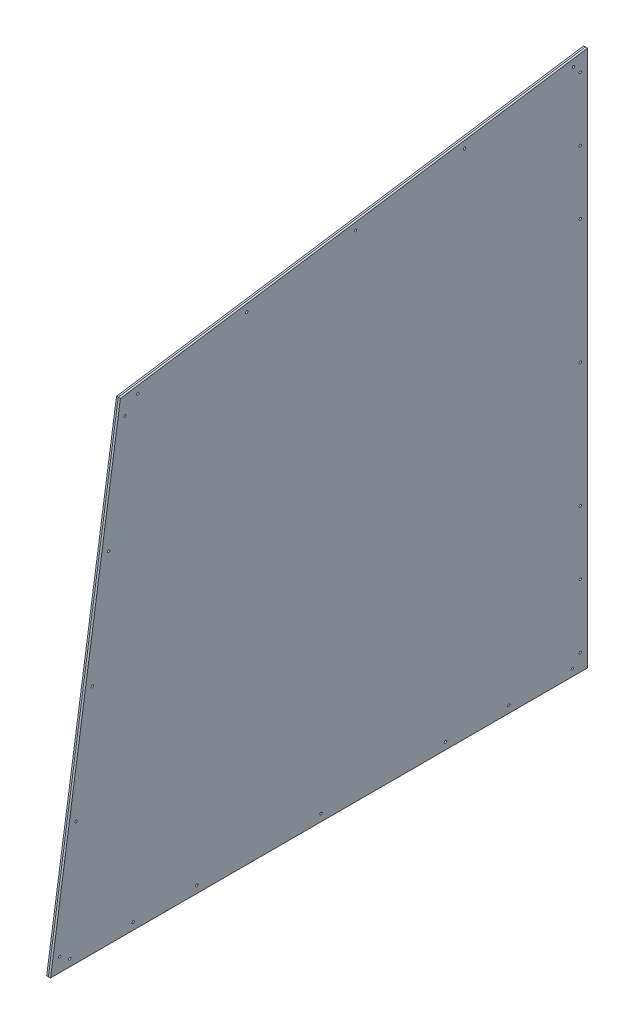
SolidWorks part; units mm, degrees
ref_plane "Front Plane" through (0, 0, 0) normal (0, 0, 1) x (1, 0, 0)
ref_plane "Top Plane" through (0, 0, 0) normal (0, 1, 0) x (1, 0, 0)
ref_plane "Right Plane" through (0, 0, 0) normal (1, 0, 0) x (0, 0, -1)
sketch "Sketch2" plane through (0, 0, 0) normal (1, 0, 0) x (0, 0, -1)
  line L0 (-4.3656, 1212.1971) -> (-1055.0672, 1055.0672) construction
  line L1 (-1212.1971, 4.3656) -> (-1055.0672, 1055.0672) construction
  line L2 (-4.3656, 4.3656) -> (-1212.1971, 4.3656) construction
  line L3 (-4.3656, 4.3656) -> (-4.3656, 1212.1971) construction
  line L4 (-4.3656, 1212.1971) -> (-1055.0672, 1055.0672)
  line L5 (-1212.1971, 4.3656) -> (-1055.0672, 1055.0672)
  line L6 (-4.3656, 4.3656) -> (-1212.1971, 4.3656)
  line L7 (-4.3656, 4.3656) -> (-4.3656, 1212.1971)
extrude "Boss-Extrude1" add sketch "Sketch2" along normal mid plane 8.7312
sketch "Sketch3" plane through (0, 4.3656, 0) normal (0, -1, 0) x (1, 0, 0)
  line L0 (0, 1212.1971) -> (4.3656, 1211.5443)
  line L1 (4.3656, 1212.1971) -> (-4.3656, 1212.1971) construction
  line L2 (0, 1212.1971) -> (-4.3656, 1211.5443)
  line L3 (-4.3656, 1211.5443) -> (-4.3656, 1214.7371)
  line L4 (4.3656, 1211.5443) -> (4.3656, 1214.7371)
  line L5 (4.3656, 1214.7371) -> (-4.3656, 1214.7371)
  line L6 (4.3656, 1212.1971) -> (4.3656, 4.3656) construction
  line L7 (-4.3656, 1212.1971) -> (-4.3656, 4.3656) construction
  line L8 (0, 1212.85) -> (1055.0672, 1055.0672) construction
  dimension "D1" = 2.54
  dimension "D2" = 8.505
extrude "Cut-Extrude1" cut sketch "Sketch3" along direction (0, -0.989, 0.1479) on the side against the normal through all
sketch "Sketch4" plane through (0, 0, 4.3656) normal (0, 0, -1) x (-1, 0, 0)
  line L0 (0, 1212.1971) -> (-4.3656, 1211.5443)
  line L1 (-4.3656, 1212.1971) -> (4.3656, 1212.1971) construction
  line L2 (0, 1212.1971) -> (4.3656, 1211.5443)
  line L3 (-4.3656, 1211.5443) -> (-4.3656, 1214.7371)
  line L4 (-4.3656, 1214.7371) -> (4.3656, 1214.7371)
  line L5 (4.3656, 1214.7371) -> (4.3656, 1211.5443)
  line L6 (-4.3656, 4.3656) -> (-4.3656, 1212.1971) construction
  line L7 (4.3656, 4.3656) -> (4.3656, 1212.1971) construction
  line L8 (0, 1212.85) -> (-1055.0672, 1055.0672) construction
  dimension "D1" = 2.54
  dimension "D2" = 8.505
extrude "Cut-Extrude2" cut sketch "Sketch4" along direction (0, -0.1479, 0.989) on the side against the normal through all
sketch "Sketch5" plane through (4.3656, 0, 0) normal (1, 0, 0) x (0, 0, -1)
  line L0 (-4.3656, 20.2406) -> (-38.1, 20.2406) construction
  line L1 (-4.3656, 4.3656) -> (-4.3656, 1211.5443) construction
  line L2 (-1211.5443, 4.3656) -> (-4.3656, 4.3656) construction
  line L3 (-38.1, 20.2406) -> (-180.975, 20.2406) construction
  line L4 (-180.975, 20.2406) -> (-323.85, 20.2406) construction
  line L5 (-323.85, 20.2406) -> (-603.25, 20.2406) construction
  line L6 (-603.25, 20.2406) -> (-882.65, 20.2406) construction
  line L7 (-882.65, 20.2406) -> (-1025.525, 20.2406) construction
  line L8 (-1025.525, 20.2406) -> (-1168.4, 20.2406) construction
  line L9 (-1168.4, 20.2406) -> (-1209.1702, 20.2406) construction
  line L10 (-1211.5443, 4.3656) -> (-1054.4993, 1054.4993) construction
  line L11 (-20.2406, 4.3656) -> (-20.2406, 42.4656) construction
  line L12 (-1211.5443, 4.3656) -> (-4.3656, 4.3656) construction
  line L13 (-4.3656, 4.3656) -> (-4.3656, 1211.5443) construction
  line L14 (-20.2406, 42.4656) -> (-20.2406, 185.3406) construction
  line L15 (-20.2406, 185.3406) -> (-20.2406, 328.2156) construction
  line L16 (-20.2406, 328.2156) -> (-20.2406, 607.6156) construction
  line L17 (-20.2406, 607.6156) -> (-20.2406, 887.0156) construction
  line L18 (-20.2406, 887.0156) -> (-20.2406, 1029.8906) construction
  line L19 (-20.2406, 1029.8906) -> (-20.2406, 1172.7656) construction
  line L20 (-20.2406, 1172.7656) -> (-20.2406, 1209.1702) construction
  line L21 (-1054.4993, 1054.4993) -> (-4.3656, 1211.5443) construction
  line L23 (-35.6765, 1190.7586) -> (-280.6029, 1154.1304) construction
  line L24 (-280.6029, 1154.1304) -> (-525.5292, 1117.5023) construction
  line L25 (-525.5292, 1117.5023) -> (-770.4555, 1080.8741) construction
  line L26 (-770.4555, 1080.8741) -> (-1015.3818, 1044.246) construction
  line L27 (-1015.3818, 1044.246) -> (-1056.9626, 1038.0277) construction
  line L29 (-1190.7963, 35.4213) -> (-1154.1682, 280.3477) construction
  line L30 (-1154.1682, 280.3477) -> (-1117.54, 525.274) construction
  line L31 (-1117.54, 525.274) -> (-1080.9119, 770.2003) construction
  line L32 (-1080.9119, 770.2003) -> (-1044.2837, 1015.1266) construction
  line L33 (-1044.2837, 1015.1266) -> (-1038.0273, 1056.9626) construction
  circle A0 centre (-525.5292, 1117.5023) radius 2.5794
  circle A1 centre (-770.4555, 1080.8741) radius 2.5794
  circle A2 centre (-1015.3818, 1044.246) radius 2.5794
  circle A3 centre (-1044.2837, 1015.1266) radius 2.5794
  circle A4 centre (-1080.9119, 770.2003) radius 2.5794
  circle A5 centre (-1117.54, 525.274) radius 2.5794
  circle A6 centre (-1154.1682, 280.3477) radius 2.5794
  circle A7 centre (-1190.7963, 35.4213) radius 2.5794
  circle A8 centre (-1168.4, 20.2406) radius 2.5794
  circle A9 centre (-1025.525, 20.2406) radius 2.5794
  circle A10 centre (-882.65, 20.2406) radius 2.5794
  circle A11 centre (-603.25, 20.2406) radius 2.5794
  circle A12 centre (-323.85, 20.2406) radius 2.5794
  circle A13 centre (-180.975, 20.2406) radius 2.5794
  circle A14 centre (-38.1, 20.2406) radius 2.5794
  circle A15 centre (-20.2406, 42.4656) radius 2.5794
  circle A16 centre (-20.2406, 185.3406) radius 2.5794
  circle A17 centre (-20.2406, 328.2156) radius 2.5794
  circle A18 centre (-20.2406, 607.6156) radius 2.5794
  circle A19 centre (-20.2406, 887.0156) radius 2.5794
  circle A20 centre (-20.2406, 1029.8906) radius 2.5794
  circle A21 centre (-20.2406, 1172.7656) radius 2.5794
  circle A22 centre (-35.6765, 1190.7586) radius 2.5794
  circle A23 centre (-280.6029, 1154.1304) radius 2.5794
  circle A24 centre (-35.6765, 1190.7586) radius 2.5527 construction
  ellipse E0 centre (-1190.7963, 35.4213) end of major axis (-1188.2711, 35.0478) minor radius 2.5521 construction
  dimension "D26" = 5.1587
  dimension "D1" = 15.875
  dimension "D2" = 33.7344
  dimension "D3" = 142.875
  dimension "D4" = 142.875
  dimension "D5" = 279.4
  dimension "D6" = 279.4
  dimension "D7" = 142.875
  dimension "D8" = 142.875
  dimension "D9" = 40.7702
  dimension "D10" = 15.875
  dimension "D11" = 38.1
  dimension "D12" = 142.875
  dimension "D13" = 142.875
  dimension "D14" = 279.4
  dimension "D15" = 279.4
  dimension "D16" = 142.875
  dimension "D17" = 142.875
  dimension "D20" = 247.65
  dimension "D21" = 42.0431
  dimension "D24" = 247.65
  dimension "D25" = 42.3013
  dimension "D27" = 38.1
extrude "Cut-Extrude3" cut sketch "Sketch5" against normal through all
sketch "Sketch6" plane through (-4.3656, 0, 0) normal (-1, 0, 0) x (0, 0, 1)
  line L0 (1211.5443, 4.3656) -> (4.3656, 4.3656) construction
  line L1 (207.5656, 4.3656) -> (1006.7375, 4.3656)
  line L2 (207.5656, 4.3656) -> (207.5656, 775.8906)
  line L3 (309.1656, 877.4906) -> (788.6279, 877.4906)
  line L4 (1006.7375, 4.3656) -> (889.1105, 790.9176)
  line L5 (4.3656, 4.3656) -> (4.3656, 1211.5443) construction
  line L6 (1055.0672, 1055.0672) -> (1212.1971, 4.3656) construction
  arc A0 (788.6279, 877.4906) -> (889.1105, 790.9176) centre (788.6279, 775.8906) cw
  arc A1 (207.5656, 775.8906) -> (309.1656, 877.4906) centre (309.1656, 775.8906) cw
  dimension "D4" = 101.6
  dimension "D1" = 203.2
  dimension "D2" = 203.2
  dimension "D3" = 873.125
sketch "Sketch9" plane through (-4.3656, 0, 0) normal (-1, 0, 0) x (0, 0, 1)
  line L0 (1211.5443, 4.3656) -> (4.3656, 4.3656) construction
  line L1 (813.7836, 808.6436) -> (324.1926, 881.8607)
  line L2 (899.2393, 723.1879) -> (1006.7375, 4.3656)
  line L3 (1006.7375, 4.3656) -> (207.5656, 4.3656)
  line L4 (207.5656, 781.3781) -> (207.5656, 4.3656)
  line L5 (1055.0672, 1055.0672) -> (1212.1971, 4.3656) construction
  line L7 (1055.0672, 1055.0672) -> (4.3656, 1212.1971) construction
  line L8 (4.3656, 4.3656) -> (4.3656, 1211.5443) construction
  arc A0 (324.1926, 881.8607) -> (207.5656, 781.3781) centre (309.1656, 781.3781) ccw
  arc A1 (813.7836, 808.6436) -> (899.2393, 723.1879) centre (798.7567, 708.161) cw
  dimension "D1" = 101.6
  dimension "D2" = 203.2
  dimension "D3" = 279.4
  dimension "D4" = 203.2
sketch "Sketch7" [suppressed] plane through (-4.3656, 0, 0) normal (-1, 0, 0) x (0, 0, 1)
  line L4 (324.1926, 881.8607) -> (813.7836, 808.6436)
  line L5 (1006.7375, 4.3656) -> (899.2393, 723.1879)
  line L6 (207.5656, 4.3656) -> (1006.7375, 4.3656)
  line L7 (207.5656, 4.3656) -> (207.5656, 781.3781)
  line L8 (1211.5443, 4.3656) -> (4.3656, 4.3656) construction
  line L9 (899.2393, 723.1879) -> (1006.7375, 4.3656) construction
  line L10 (207.5656, 781.3781) -> (207.5656, 4.3656) construction
  line L11 (813.7836, 808.6436) -> (324.1926, 881.8607) construction
  arc A2 (899.2393, 723.1879) -> (813.7836, 808.6436) centre (798.7567, 708.161) ccw
  arc A3 (324.1926, 881.8607) -> (207.5656, 781.3781) centre (309.1656, 781.3781) ccw
  arc A4 (899.2393, 723.1879) -> (813.7836, 808.6436) centre (798.7567, 708.161) ccw construction
  arc A5 (324.1926, 881.8607) -> (207.5656, 781.3781) centre (309.1656, 781.3781) ccw construction
extrude "Cut-Extrude4" [suppressed] cut sketch "Sketch7" against normal through all
sketch "Sketch8" [suppressed] plane through (-4.3656, 0, 0) normal (-1, 0, 0) x (0, 0, 1)
  line L3 (207.5656, 309.1656) -> (207.5656, 781.3781)
  line L4 (324.1926, 881.8607) -> (813.7836, 808.6436)
  line L5 (958.9081, 324.1926) -> (899.2393, 723.1879)
  line L6 (309.1656, 207.5656) -> (858.4255, 207.5656)
  line L7 (813.7836, 808.6436) -> (324.1926, 881.8607) construction
  line L10 (207.5656, 781.3781) -> (207.5656, 4.3656) construction
  line L11 (899.2393, 723.1879) -> (1006.7375, 4.3656) construction
  line L13 (1211.5443, 4.3656) -> (4.3656, 4.3656) construction
  arc A2 (324.1926, 881.8607) -> (207.5656, 781.3781) centre (309.1656, 781.3781) ccw
  arc A3 (899.2393, 723.1879) -> (813.7836, 808.6436) centre (798.7567, 708.161) ccw
  arc A4 (207.5656, 309.1656) -> (309.1656, 207.5656) centre (309.1656, 309.1656) ccw
  arc A5 (958.9081, 324.1926) -> (858.4255, 207.5656) centre (858.4255, 309.1656) cw
  arc A6 (899.2393, 723.1879) -> (813.7836, 808.6436) centre (798.7567, 708.161) ccw construction
  arc A7 (324.1926, 881.8607) -> (207.5656, 781.3781) centre (309.1656, 781.3781) ccw construction
  dimension "D1" = 203.2
extrude "Cut-Extrude5" [suppressed] cut sketch "Sketch8" against normal through all
sketch "Sketch10" [suppressed] plane through (4.3656, 0, 0) normal (1, 0, 0) x (0, 0, -1)
  line L0 (-309.1656, 877.4906) -> (-788.6279, 877.4906) construction
  line L1 (-1006.7375, 4.3656) -> (-889.1105, 790.9176) construction
  line L2 (-207.5656, 4.3656) -> (-1006.7375, 4.3656) construction
  line L3 (-207.5656, 4.3656) -> (-207.5656, 775.8906) construction
  line L4 (-309.1656, 877.4906) -> (-788.6279, 877.4906)
  line L5 (-1006.7375, 4.3656) -> (-889.1105, 790.9176)
  line L6 (-207.5656, 4.3656) -> (-1006.7375, 4.3656)
  line L7 (-207.5656, 4.3656) -> (-207.5656, 775.8906)
  arc A0 (-788.6279, 877.4906) -> (-889.1105, 790.9176) centre (-788.6279, 775.8906) ccw construction
  arc A1 (-207.5656, 775.8906) -> (-309.1656, 877.4906) centre (-309.1656, 775.8906) ccw construction
  arc A2 (-788.6279, 877.4906) -> (-889.1105, 790.9176) centre (-788.6279, 775.8906) ccw
  arc A3 (-207.5656, 775.8906) -> (-309.1656, 877.4906) centre (-309.1656, 775.8906) ccw
extrude "Cut-Extrude6" [suppressed] cut sketch "Sketch10" against normal through all
sketch "Sketch11" [suppressed] plane through (4.3656, 0, 0) normal (1, 0, 0) x (0, 0, -1)
  line L0 (-309.1656, 877.4906) -> (-788.6279, 877.4906) construction
  line L1 (-1006.7375, 4.3656) -> (-889.1105, 790.9176) construction
  line L3 (-207.5656, 4.3656) -> (-207.5656, 775.8906) construction
  line L4 (-309.1656, 877.4906) -> (-788.6279, 877.4906)
  line L5 (-958.9081, 324.1926) -> (-889.1105, 790.9176)
  line L6 (-309.1656, 207.5656) -> (-858.4255, 207.5656)
  line L7 (-207.5656, 309.1656) -> (-207.5656, 775.8906)
  line L8 (-1211.5443, 4.3656) -> (-4.3656, 4.3656) construction
  arc A0 (-788.6279, 877.4906) -> (-889.1105, 790.9176) centre (-788.6279, 775.8906) ccw construction
  arc A1 (-207.5656, 775.8906) -> (-309.1656, 877.4906) centre (-309.1656, 775.8906) ccw construction
  arc A2 (-788.6279, 877.4906) -> (-889.1105, 790.9176) centre (-788.6279, 775.8906) ccw
  arc A3 (-207.5656, 775.8906) -> (-309.1656, 877.4906) centre (-309.1656, 775.8906) ccw
  arc A4 (-309.1656, 207.5656) -> (-207.5656, 309.1656) centre (-309.1656, 309.1656) ccw
  arc A5 (-958.9081, 324.1926) -> (-858.4255, 207.5656) centre (-858.4255, 309.1656) ccw
  dimension "D1" = 101.6
  dimension "D2" = 203.2
extrude "Cut-Extrude7" [suppressed] cut sketch "Sketch11" against normal through all
